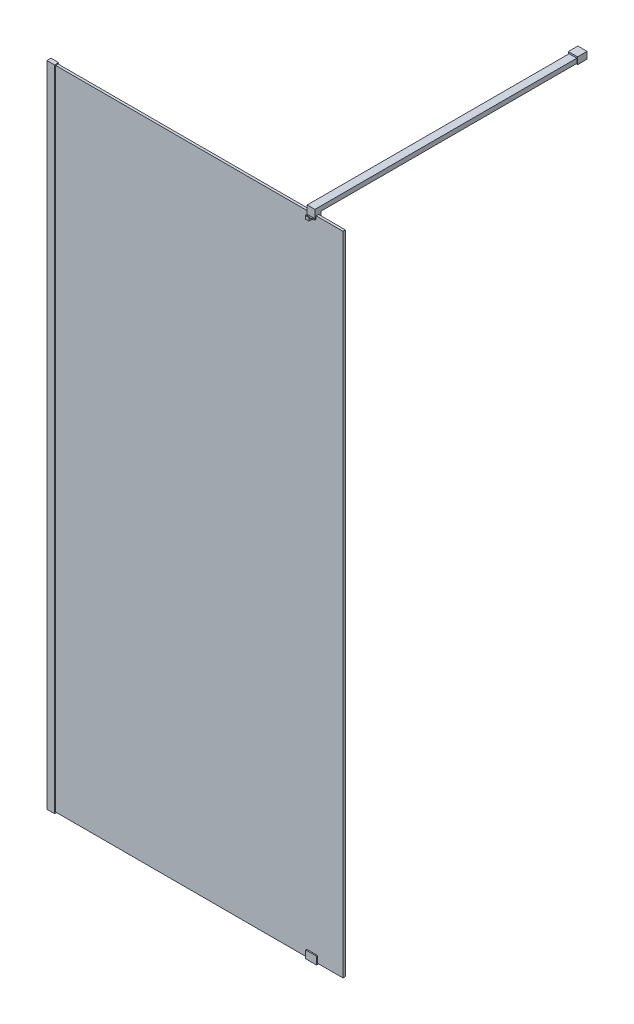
SolidWorks part; units mm, degrees
ref_plane "Płaszczyzna przednia" through (0, 0, 0) normal (0, 0, 1) x (1, 0, 0)
ref_plane "Płaszczyzna górna" through (0, 0, 0) normal (0, 1, 0) x (1, 0, 0)
ref_plane "Płaszczyzna prawa" through (0, 0, 0) normal (1, 0, 0) x (0, 0, -1)
sketch "Szkic1" plane through (0, 0, 0) normal (0, 1, 0) x (1, 0, 0)
  line L0 (0, 0) -> (0, 13.3)
  line L2 (0, 13.3) -> (25, 13.3)
  line L3 (25, 13.3) -> (25, 11.4)
  line L4 (25, 11.4) -> (11.45, 11.4)
  line L5 (11.45, 11.4) -> (11.45, 3.4)
  line L6 (11.45, 3.4) -> (25, 3.4)
  line L7 (25, 3.4) -> (25, 0)
  line L8 (25, 0) -> (0, 0)
  dimension "D1" = 13.3
  dimension "D4" = 1.9
  dimension "D5" = 8
  dimension "D6" = 3.4
  dimension "D7" = 13.55
  dimension "D8" = 25
extrude "Dodanie-wyciągnięcie1" add sketch "Szkic1" along normal blind 2100
sketch "Szkic2" plane through (0, 0, 0) normal (0, -1, 0) x (1, 0, 0)
  line L0 (11.45, -3.4) -> (958.45, -3.4)
  line L1 (11.45, -3.4) -> (11.45, -11.4)
  line L2 (958.45, -3.4) -> (958.45, -11.4)
  line L3 (11.45, -11.4) -> (958.45, -11.4)
  line L4 (11.45, -11.4) -> (25, -11.4) construction
  dimension "D1" = 947
extrude "Dodanie-wyciągnięcie2" add sketch "Szkic2" against normal blind 2100 separate body
sketch "Szkic4" plane through (0, 2100, 0) normal (0, 1, 0) x (1, 0, 0)
  line L1 (25, 13.3) -> (0, 13.3) construction
  line L2 (25, 11.4) -> (25, 13.3) construction
  line L3 (0, 13.3) -> (0, 0) construction
  line L5 (0, 0) -> (25, 0) construction
  line L7 (25, 13.3) -> (0, 13.3)
  line L8 (25, 0) -> (25, 13.3)
  line L9 (0, 13.3) -> (0, 0)
  line L11 (0, 0) -> (25, 0)
extrude "Dodanie-wyciągnięcie3" add sketch "Szkic4" along normal blind 3
sketch "Szkic5" plane through (0, 0, 0) normal (0, -1, 0) x (1, 0, 0)
  line L1 (0, 0) -> (25, 0) construction
  line L2 (25, 0) -> (25, -3.4) construction
  line L3 (0, -13.3) -> (0, 0) construction
  line L5 (25, -13.3) -> (0, -13.3) construction
  line L7 (0, 0) -> (25, 0)
  line L8 (25, 0) -> (25, -13.3)
  line L9 (0, -13.3) -> (0, 0)
  line L11 (25, -13.3) -> (0, -13.3)
extrude "Dodanie-wyciągnięcie4" add sketch "Szkic5" along normal blind 3
ref_plane "Płaszczyzna1" through (858.45, 0, 0) normal (1, 0, 0) x (0, 0, -1)
sketch "Szkic6" plane through (858.45, 0, 0) normal (1, 0, 0) x (0, 0, -1)
  line L0 (11.4, 22) -> (15.75, 22)
  line L1 (15.75, 22) -> (15.75, -3)
  line L2 (15.75, -3) -> (-0.35, -3)
  line L3 (-0.35, -3) -> (-0.35, 22)
  line L4 (-0.35, 22) -> (3.4, 22)
  line L5 (11.4, 22) -> (11.4, 0)
  line L6 (11.4, 0) -> (11.4, 2100)
  line L7 (11.4, 0) -> (11.4, 2100) construction
  line L8 (3.4, 2100) -> (3.4, 0)
  line L9 (3.4, 2100) -> (3.4, 0) construction
  line L10 (11.4, 0) -> (3.4, 0)
  line L11 (3.4, 0) -> (3.4, 22)
  dimension "D1" = 4.35
  dimension "D2" = 25
  dimension "D3" = 3
  dimension "D4" = 3.75
extrude "Dodanie-wyciągnięcie5" add sketch "Szkic6" along normal mid plane 35 separate body
sketch "Szkic7" plane through (858.45, 0, 0) normal (1, 0, 0) x (0, 0, -1)
  line L0 (3.4, 2100) -> (3.4, 0) construction
  line L1 (-0.6, 2120) -> (19.4, 2120)
  line L2 (3.4, 2100) -> (3.4, 0) construction
  line L4 (11.4, 2100) -> (3.4, 2100) construction
  line L13 (11.4, 2100) -> (11.4, 0) construction
  line L20 (19.4, 2120) -> (19.4, 2090)
  line L25 (19.4, 2090) -> (11.4, 2090)
  line L26 (11.4, 2090) -> (11.4, 2100)
  line L27 (11.4, 2100) -> (3.4, 2100)
  line L28 (3.4, 2100) -> (3.4, 2090)
  line L29 (3.4, 2090) -> (-13.37, 2090)
  line L30 (-13.37, 2090) -> (-13.37, 2100)
  line L31 (-13.37, 2100) -> (-10.37, 2100)
  line L32 (-10.37, 2100) -> (-9.8451, 2094)
  line L33 (-9.8451, 2094) -> (-0.6, 2094)
  line L34 (-0.6, 2094) -> (-0.6, 2120)
  dimension "D3" = 20
  dimension "D4" = 30
  dimension "D5" = 16.77
  dimension "D6" = 4
  dimension "D14" = 8
  dimension "D21" = 10
  dimension "D22" = 4
  dimension "D23" = 3
  dimension "D24" = 95
extrude "Dodanie-wyciągnięcie6" add sketch "Szkic7" along normal mid plane 25 separate body
sketch "Szkic8" plane through (0, 2100, 0) normal (0, 1, 0) x (1, 0, 0)
  line L0 (845.95, -0.6) -> (852.45, -3.631)
  line L1 (852.45, -3.631) -> (852.45, -13.37)
  line L2 (870.95, -0.6) -> (864.45, -3.631)
  line L3 (864.45, -3.631) -> (864.45, -13.37)
  line L4 (858.45, -10.37) -> (858.45, 156.6902) construction
  line L5 (870.95, -10.37) -> (845.95, -10.37) construction
  line L6 (852.45, -13.37) -> (864.45, -13.37)
  line L7 (870.95, -13.37) -> (845.95, -13.37) construction
  dimension "D1" = 12
  dimension "D2" = 115
extrude "Wytnij-wyciągnięcie1" cut sketch "Szkic8" against normal through all and the other way through all
sketch "Szkic10" plane through (0, 2120, 0) normal (0, 1, 0) x (1, 0, 0)
  line L0 (858.45, 31.9) -> (858.45, 19.4) construction
  line L1 (845.95, 881.03) -> (870.95, 881.03)
  line L2 (845.95, 881.03) -> (845.95, 19.4)
  line L3 (845.95, 19.4) -> (870.95, 19.4)
  line L4 (870.95, 19.4) -> (845.95, 19.4) construction
  line L5 (845.95, 19.4) -> (845.95, -0.6) construction
  line L6 (870.95, 881.03) -> (870.95, 19.4)
  point P4 (858.45, 31.9)
  dimension "D2" = 861.63
  dimension "D1" = 25
  dimension "D3" = 12.5
extrude "Dodanie-wyciągnięcie7" add sketch "Szkic10" against normal blind 15
sketch "Szkic14" plane through (0, 0, -881.03) normal (0, 0, -1) x (-1, 0, 0)
  line L1 (-873.45, 2125) -> (-843.45, 2125)
  line L2 (-873.45, 2125) -> (-873.45, 2103)
  line L3 (-873.45, 2103) -> (-843.45, 2103)
  line L4 (-843.45, 2125) -> (-843.45, 2103)
  line L5 (-873.45, 2125) -> (-843.45, 2103) construction
  line L6 (-873.45, 2103) -> (-843.45, 2125) construction
  line L7 (-858.45, 2120) -> (-858.45, 2114) construction
  line L8 (-870.95, 2120) -> (-845.95, 2120) construction
  line L9 (-870.95, 2105) -> (-845.95, 2105) construction
  point P0 (-858.45, 2114)
  dimension "D1" = 30
  dimension "D2" = 22
  dimension "D3" = 2
extrude "Dodanie-wyciągnięcie8" add sketch "Szkic14" against normal blind 31
